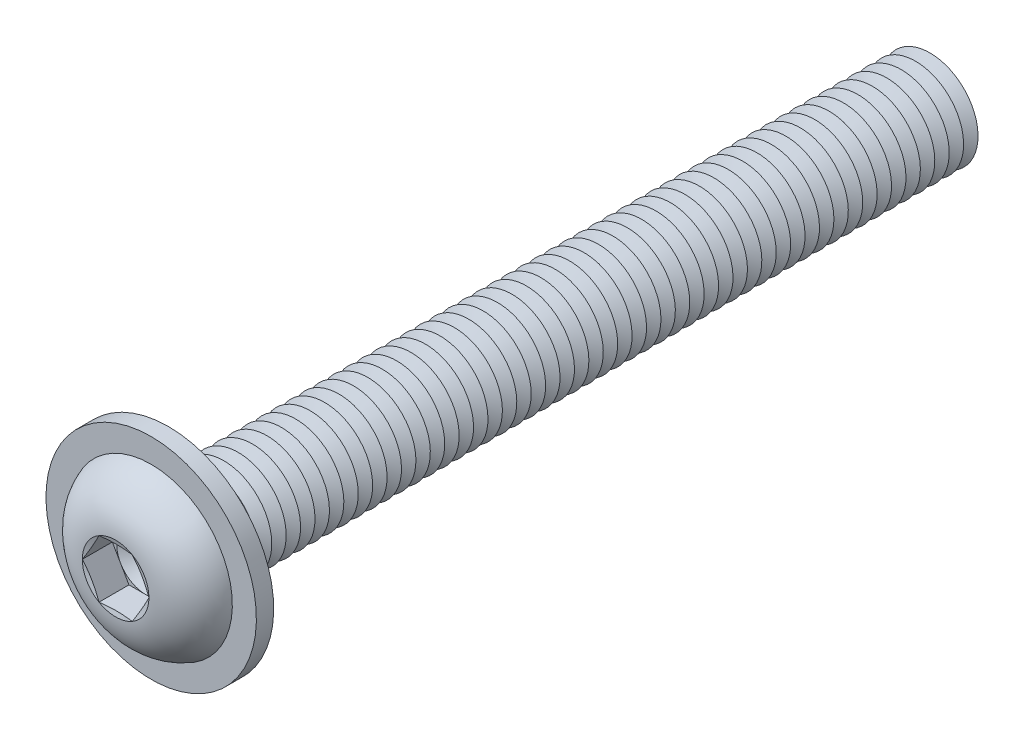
SolidWorks part; units mm, degrees
ref_plane "Front Plane" through (0, 0, 0) normal (0, 0, 1) x (1, 0, 0)
ref_plane "Top Plane" through (0, 0, 0) normal (0, 1, 0) x (1, 0, 0)
ref_plane "Right Plane" through (0, 0, 0) normal (1, 0, 0) x (0, 0, -1)
sketch "Sketch1" plane through (0, 0, 0) normal (1, 0, 0) x (0, 0, -1)
  line L0 (0, 5) -> (0, 8.75)
  line L3 (0, 5) -> (80, 5)
  line L4 (80, 5) -> (80, 0)
  line L5 (80, 0) -> (-5.5, 0) construction
  line L6 (-5.5, 0) -> (80, 0)
  line L7 (-5.5, 3.4641) -> (-5.5, 1.732) construction
  line L8 (-5.5, 1.732) -> (-5.5, 0)
  line L9 (-5.5, 3.4641) -> (-5.0359, 1.732)
  line L10 (-5.0359, 1.732) -> (-5.5, 1.732)
  line L11 (80, 0) -> (22.7481, 0) construction
  line L12 (0, 8.75) -> (-5.5, 8.75) construction
  arc A1 (0, 8.75) -> (-5.5, 3.4641) centre (0, 3.2457) ccw
  point P8 (80, 2.5)
  dimension "D1" = 17.5
  dimension "D2" = 10
  dimension "D3" = 5.5
  dimension "D4" = 6.9282
  dimension "D5" = 80
  dimension "D6" = 15
revolve "Revolve1" add sketch "Sketch1" angle 360 about L5
fillet "Fillet1" radius 0.75 1 edges at (0, 5, 0)
sketch "Sketch2" plane through (0, 0, 0) normal (1, 0, 0) x (0, 0, -1)
  line L0 (79.25, 5) -> (80.75, 5)
  line L1 (80, 5) -> (0.75, 5) construction
  line L2 (80.75, 5) -> (80, 3.701)
  line L3 (80, -5) -> (80, 5) construction
  line L4 (80, 3.701) -> (79.25, 5)
  dimension "D1" = 1.5
revolve "Cut-Revolve1" cut sketch "Sketch2" angle 360 about axis through (0, 0, -80) along (0, 0, -1)
pattern_linear "LPattern1" count 53 spacing 1.5 along (0, 0, 1) of "Cut-Revolve1"
sketch "Sketch3" plane through (0, 0, 5.5) normal (0, 0, 1) x (1, 0, 0)
  line L7 (1.732, 3) -> (-1.7321, 3)
  line L8 (-1.7321, 3) -> (-3.4641, 0)
  line L9 (-3.4641, 0) -> (-1.732, -3)
  line L10 (-1.732, -3) -> (1.732, -3)
  line L11 (1.732, -3) -> (3.4641, 0)
  line L12 (3.4641, 0) -> (1.732, 3)
  circle A0 centre (0, 0) radius 3 construction
  circle A3 centre (0, 0) radius 3.4641 construction
extrude "Cut-Extrude1" cut sketch "Sketch3" against normal blind 3.12
sketch "Sketch4" plane through (0, 0, 2.38) normal (0, 0, 1) x (1, 0, 0)
  line L1 (1.732, 3) -> (-1.7321, 3) construction
  circle A0 centre (0, 0) radius 3
extrude "Cut-Extrude2" cut sketch "Sketch4" against normal through all draft 60
sketch "Sketch5" plane through (0, 0, 0) normal (0, 0, -1) x (-1, 0, 0)
  circle A0 centre (0, 0) radius 10.95
  circle A1 centre (0, 0) radius 5.75
  circle A2 centre (0, 0) radius 5.75 construction
  dimension "D1" = 21.9
extrude "Boss-Extrude1" add sketch "Sketch5" against normal blind 1.8
